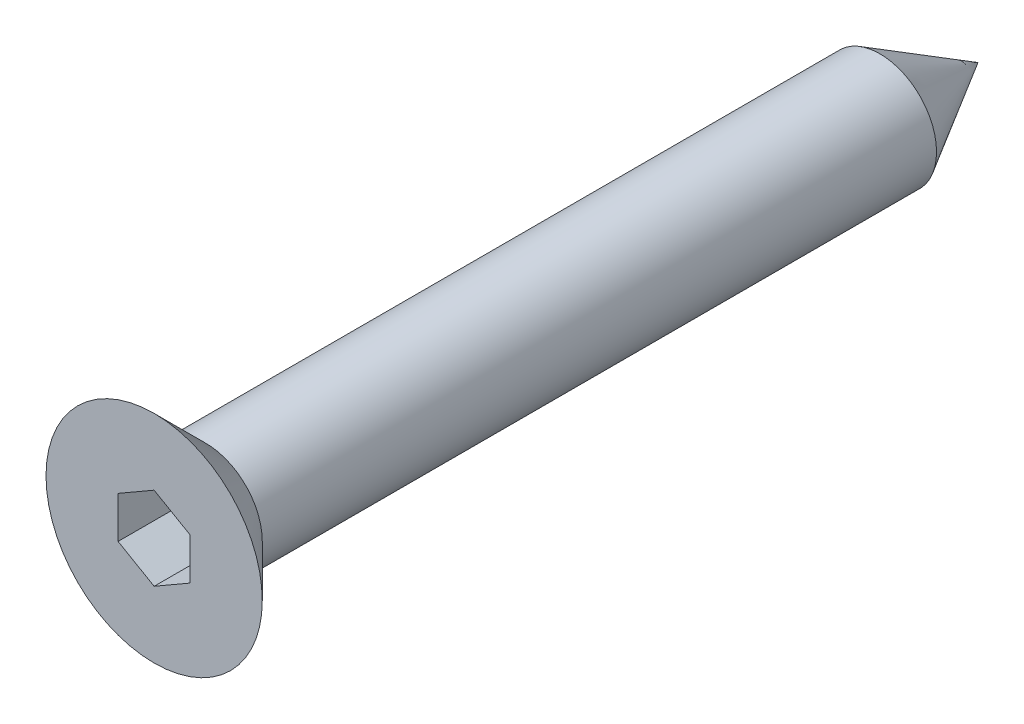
SolidWorks part; units mm, degrees
ref_plane "Plan de face" through (0, 0, 0) normal (0, 0, 1) x (1, 0, 0)
ref_plane "Plan de dessus" through (0, 0, 0) normal (0, 1, 0) x (1, 0, 0)
ref_plane "Plan de droite" through (0, 0, 0) normal (1, 0, 0) x (0, 0, -1)
sketch "Esquisse1" plane through (0, 0, 0) normal (1, 0, 0) x (0, 0, -1)
  line L0 (-1.6035, 0) -> (7.1529, 0) construction
  line L1 (0, 5.0438) -> (0, -4.594) construction
  line L2 (0, 2.1) -> (1, 1.1)
  line L3 (1, 1.1) -> (1, 0)
  line L5 (0, 2.1) -> (8.0645, -5.9645) construction
  line L6 (-1.0465, 1.1) -> (4.1553, 1.1) construction
  line L7 (1, 0) -> (0, 0)
  line L9 (0, 2.1) -> (0, 0)
  dimension "D1" = 45
revolve "Révolution2" add sketch "Esquisse1" angle 360 about L0
sketch "Esquisse3" plane through (0, 0, 0) normal (0, 0, 1) x (1, 0, 0)
  circle A0 centre (0, 0) radius 1.1
extrude "Extrusion1" add sketch "Esquisse3" against normal blind 16
sketch "Esquisse2" plane through (0, 0, 0) normal (0, 0, 1) x (1, 0, 0)
  line L1 (0, 0.8083) -> (-0.7, 0.4041)
  line L2 (-0.7, 0.4041) -> (-0.7, -0.4041)
  line L3 (-0.7, -0.4041) -> (0, -0.8083)
  line L4 (0, -0.8083) -> (0.7, -0.4041)
  line L5 (0.7, -0.4041) -> (0.7, 0.4041)
  line L6 (0.7, 0.4041) -> (0, 0.8083)
  circle A0 centre (0, 0) radius 1.8 construction
  circle A1 centre (0, 0) radius 0.7 construction
extrude "Enlèv. mat.-Extru.2" cut sketch "Esquisse2" against normal blind 1.5
chamfer "Chanfrein1" distance 1.1 angle 60 1 edges at (1.1, 0, -16)
